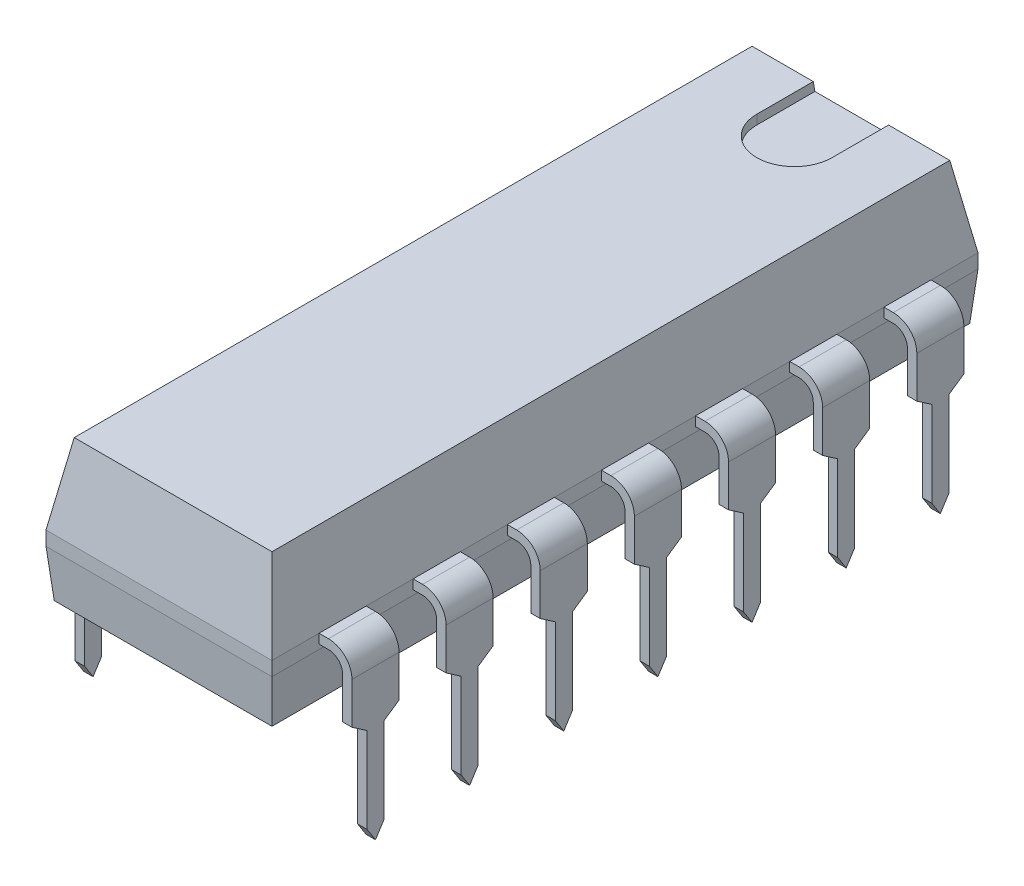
SolidWorks part; units mm, degrees
ref_plane "x/y" through (0, 0, 0) normal (0, 0, 1) x (1, 0, 0)
ref_plane "x/z" through (0, 0, 0) normal (0, 1, 0) x (1, 0, 0)
ref_plane "y/z" through (0, 0, 0) normal (1, 0, 0) x (0, 0, -1)
ref_plane "Plane1" through (0, 0.381, 0) normal (0, 1, 0) x (-1, 0, 0)
sketch "Sketch1" plane through (0, 0.381, 0) normal (0, 1, 0) x (0, 0, -1)
  line L1 (1.905, -0.762) -> (-17.145, -0.762)
  line L2 (1.905, -0.762) -> (1.905, -6.858)
  line L3 (1.905, -6.858) -> (-17.145, -6.858)
  line L4 (-17.145, -0.762) -> (-17.145, -6.858)
  dimension "D1" = 17.145
  dimension "D2" = 1.905
  dimension "D3" = 6.096
  dimension "D4" = 0.762
extrude "Base-Extrude" add sketch "Sketch1" along normal blind 3.81
ref_plane "Plane2" through (6.858, 0, 0) normal (1, 0, 0) x (0, 0, -1)
ref_plane "Plane5" through (0, 0, 17.145) normal (0, 0, 1) x (1, 0, 0)
chamfer "Chamfer1" distance 2.159 angle 10 4 edges at (3.81, 4.191, 17.145) (6.858, 4.191, 7.62) (3.81, 4.191, -1.905) (0.762, 4.191, 7.62)
chamfer "Chamfer2" distance 1.27 angle 5 4 edges at (6.858, 0.381, 7.62) (3.81, 0.381, 17.145) (0.762, 0.381, 7.62) (3.81, 0.381, -1.905)
sketch "Sketch2" plane through (0, 4.191, 0) normal (0, 1, 0) x (-1, 0, 0)
  line L0 (-3.81, -1.905) -> (-3.81, 5.1432) construction
  line L1 (-0.762, -1.905) -> (-6.858, -1.905) construction
  line L2 (-6.4773, -1.5243) -> (-1.1427, -1.5243) construction
  line L4 (-2.794, -1.905) -> (-4.826, -1.905)
  line L5 (-2.794, -1.905) -> (-2.794, -0.0003)
  line L7 (-4.826, -1.905) -> (-4.826, -0.0003)
  arc A0 (-2.794, -0.0003) -> (-4.826, -0.0003) centre (-3.81, -0.0003) ccw
  dimension "D2" = 2.032
  dimension "D3" = 1.016
  dimension "D1" = 1.016
  dimension "D4" = 1.524
extrude "Cut-Extrude1" cut sketch "Sketch2" against normal blind 0.254
ref_plane "Plane6" through (8.763, 0, 0) normal (1, 0, 0) x (0, 0, -1)
sketch "Sketch3" plane through (9.017, 0, 0) normal (0, 0, -1) x (-1, 0, 0)
  line L0 (9.017, 1.397) -> (9.017, -2.667)
  line L1 (8.509, 1.905) -> (6.364, 1.905)
  line L3 (8.1439, 0.381) -> (2.2701, 0.381) construction
  arc A0 (8.509, 1.905) -> (9.017, 1.397) centre (8.509, 1.397) cw
  dimension "D2" = 1.524
  dimension "D1" = 0.508
  dimension "D3" = 4.064
extrude "Boss-Extrude-Thin1" add sketch "Sketch3" along normal mid plane 1.27 thin
sketch "Sketch4" plane through (0.127, 0, 0) normal (1, 0, 0) x (0, 0, -1)
  line L0 (-0.635, 0.2794) -> (-0.2286, 0)
  line L1 (-0.2286, 0) -> (-0.2286, -2.3095)
  line L2 (-0.2286, -2.3095) -> (0, -2.667)
  line L3 (0, 0) -> (0, -2.9486) construction
  line L4 (0.635, -2.667) -> (-0.635, -2.667) construction
  line L5 (-0.635, -2.667) -> (-0.635, 1.397) construction
  line L6 (0, -2.667) -> (-0.635, -2.667)
  line L7 (-0.635, -2.667) -> (-0.635, 0.2794)
  dimension "D1" = 2.9464
  dimension "D2" = 0.4064
extrude "Cut-Extrude2" cut sketch "Sketch4" against normal up to vertex (0.254 mm away)
sketch "Sketch5" plane through (0.127, 0, 0) normal (1, 0, 0) x (0, 0, -1)
  line L0 (0.635, -2.667) -> (0, -2.667) construction
  line L1 (0.635, -2.667) -> (0, -2.667)
  line L2 (0.635, -2.667) -> (0.635, 0.2794)
  line L3 (0.635, 0.2794) -> (0.2286, 0)
  line L4 (0.635, -2.667) -> (0.635, 1.397) construction
  line L5 (0.2286, 0) -> (0.2286, -2.3095)
  line L6 (0.2286, -2.3095) -> (0, -2.667)
  line L7 (0, -2.667) -> (-0.2286, -2.3095) construction
  line L8 (-0.2286, 0) -> (-0.635, 0.2794) construction
extrude "Cut-Extrude3" cut sketch "Sketch5" against normal up to vertex (0.254 mm away)
ref_plane "Plane9" through (3.81, 0, 0) normal (1, 0, 0) x (0, 0, -1)
pattern_linear "LPattern1" count 7 spacing 2.54 along (0, 0, 1) of "Boss-Extrude-Thin1", "Cut-Extrude3", "Cut-Extrude2"
mirror "Mirror1" about plane through (3.81, 0, 0) normal (1, 0, 0) of "LPattern1", "Boss-Extrude-Thin1", "Cut-Extrude2", "Cut-Extrude3"
sketch "Mounting_Plane" plane through (0, 0, 0) normal (0, 1, 0) x (1, 0, 0)
  line L1 (-0.127, -2.54) -> (0.127, -2.54) construction
  line L2 (-0.127, -5.08) -> (0.127, -5.08) construction
  line L3 (-0.127, -7.62) -> (0.127, -7.62) construction
  line L4 (-0.127, -10.16) -> (0.127, -10.16) construction
  line L5 (-0.127, -12.7) -> (0.127, -12.7) construction
  line L6 (-0.127, -15.24) -> (0.127, -15.24) construction
  line L7 (7.747, -15.24) -> (7.493, -15.24) construction
  line L8 (7.747, -12.7) -> (7.493, -12.7) construction
  line L9 (7.747, -10.16) -> (7.493, -10.16) construction
  line L10 (7.747, -7.62) -> (7.493, -7.62) construction
  line L11 (7.747, -5.08) -> (7.493, -5.08) construction
  line L12 (7.747, -2.54) -> (7.493, -2.54) construction
  line L13 (7.747, 0) -> (7.493, 0) construction
  circle A0 centre (0, 0) radius 0.381
  circle A1 centre (0, -2.54) radius 0.381
  circle A2 centre (0, -5.08) radius 0.381
  circle A3 centre (0, -7.62) radius 0.381
  circle A4 centre (0, -10.16) radius 0.381
  circle A5 centre (0, -12.7) radius 0.381
  circle A6 centre (0, -15.24) radius 0.381
  circle A7 centre (7.62, -15.24) radius 0.381
  circle A8 centre (7.62, -12.7) radius 0.381
  circle A9 centre (7.62, -10.16) radius 0.381
  circle A10 centre (7.62, -7.62) radius 0.381
  circle A11 centre (7.62, -5.08) radius 0.381
  circle A12 centre (7.62, -2.54) radius 0.381
  circle A13 centre (7.62, 0) radius 0.381
